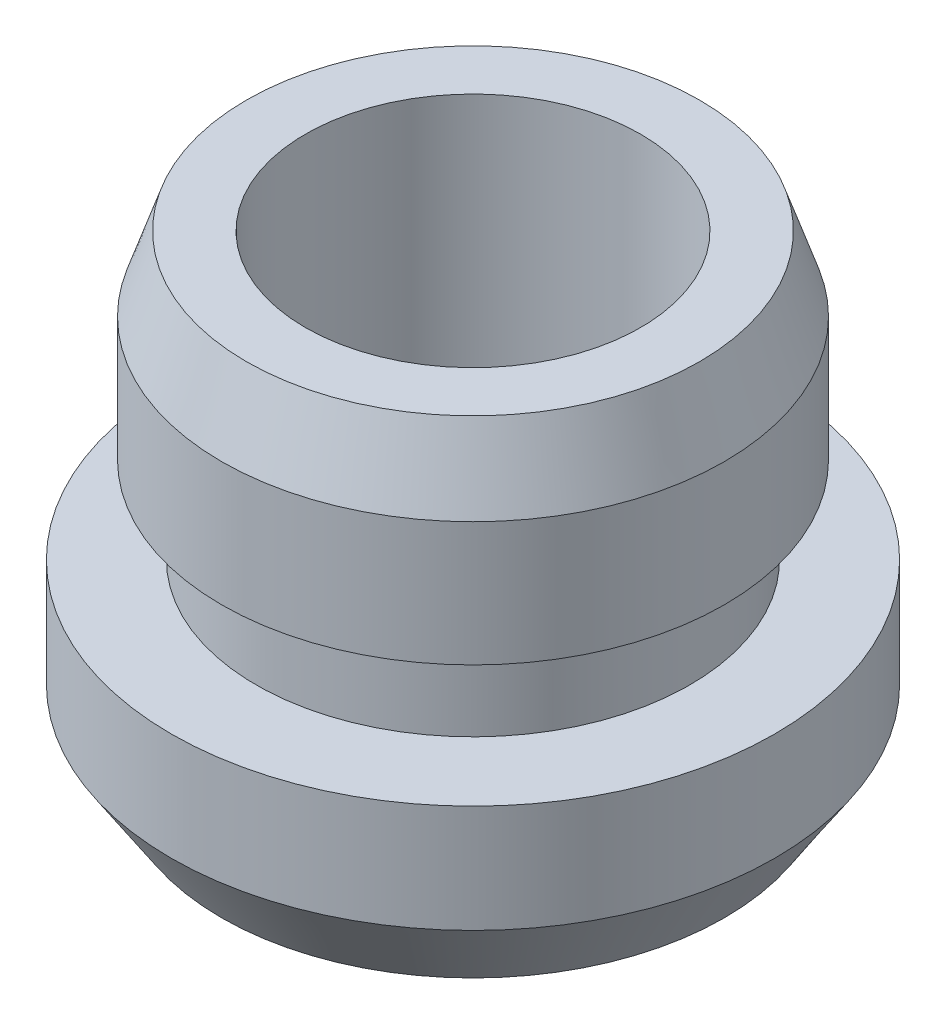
SolidWorks part; units mm, degrees
ref_plane "Plan de face" through (0, 0, 0) normal (0, 0, 1) x (1, 0, 0)
ref_plane "Plan de dessus" through (0, 0, 0) normal (0, 1, 0) x (1, 0, 0)
ref_plane "Plan de droite" through (0, 0, 0) normal (1, 0, 0) x (0, 0, -1)
sketch "Esquisse1" plane through (0, 0, 0) normal (0, 0, 1) x (1, 0, 0)
  line L0 (-5, 0) -> (-7.5, 0)
  line L1 (-7.5, 0) -> (-9, 2.2886)
  line L2 (-9, 2.2886) -> (-9, 5.5)
  line L3 (-9, 5.5) -> (-6.4672, 5.5)
  line L4 (-6.4672, 5.5) -> (-6.4672, 7.4524)
  line L5 (-6.4672, 7.4524) -> (-7.5, 8.088)
  line L6 (-7.5, 8.088) -> (-7.5, 11.7875)
  line L7 (-7.5, 11.7875) -> (-6.76, 14)
  line L8 (-6.76, 14) -> (-5, 14)
  line L9 (0, 0) -> (0, 14) construction
  line L10 (-5, 14) -> (-5, 0)
  dimension "D3" = 5.5
  dimension "D5" = 14
revolve "Révolution1" add sketch "Esquisse1" angle 360 about L9
